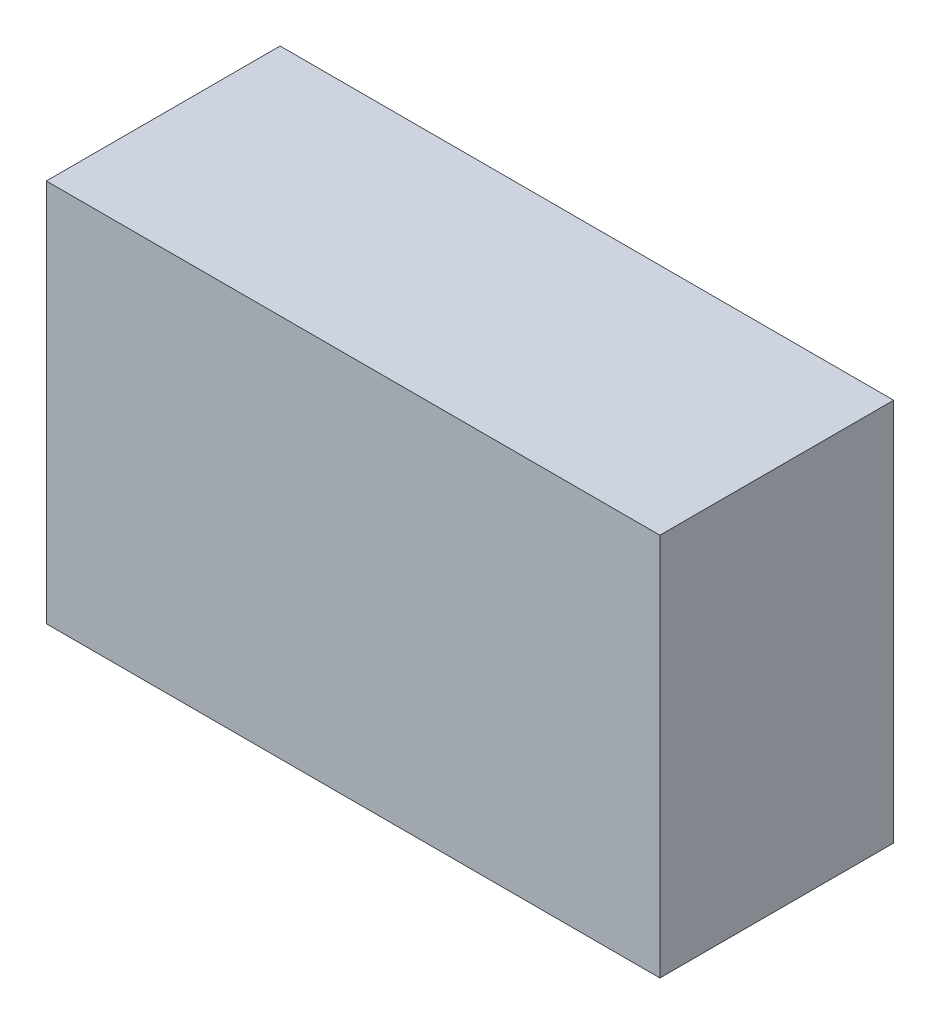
SolidWorks part; units mm, degrees
ref_plane "Front Plane" through (0, 0, 0) normal (0, 0, 1) x (1, 0, 0)
ref_plane "Top Plane" through (0, 0, 0) normal (0, 1, 0) x (1, 0, 0)
ref_plane "Right Plane" through (0, 0, 0) normal (1, 0, 0) x (0, 0, -1)
sketch "Sketch1" plane through (0, 0, 0) normal (0, 0, 1) x (1, 0, 0)
  line L0 (-1.778, 0.361) -> (0.222, 0.361)
  line L1 (0.222, 0.361) -> (0.222, -0.889)
  line L2 (0.222, -0.889) -> (-1.778, -0.889)
  line L3 (-1.778, -0.889) -> (-1.778, 0.361)
  dimension "D1" = 1.25
  dimension "D2" = 2
extrude "Component_Outline" add sketch "Sketch1" along normal blind 0.762 separate body
